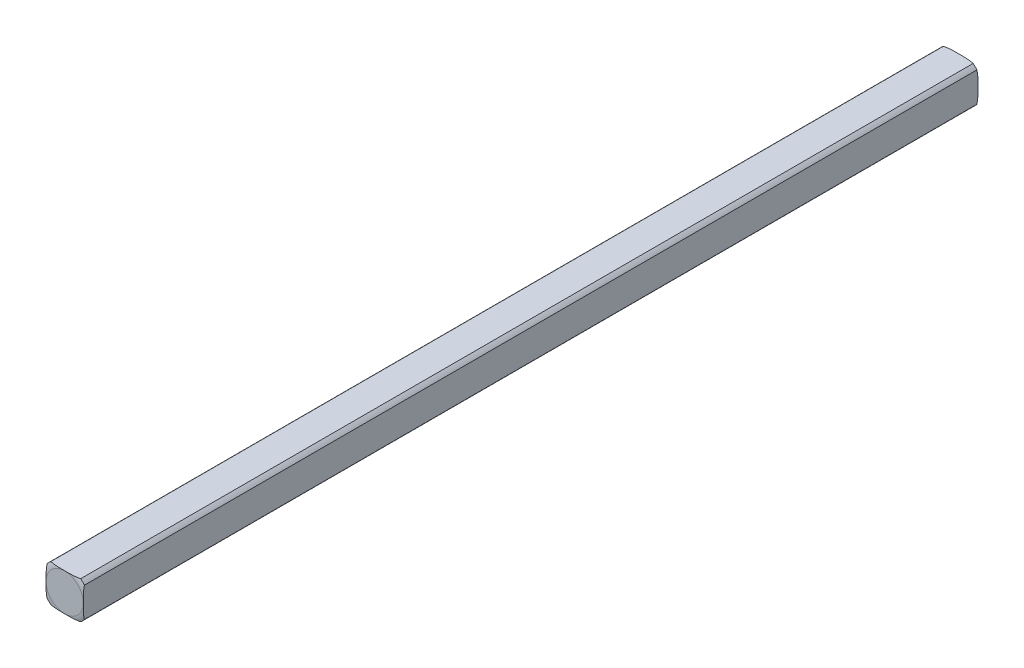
SolidWorks part; units mm, degrees
ref_plane "Front" through (0, 0, 0) normal (0, 0, 1) x (1, 0, 0)
ref_plane "Top" through (0, 0, 0) normal (0, 1, 0) x (1, 0, 0)
ref_plane "Right" through (0, 0, 0) normal (1, 0, 0) x (0, 0, -1)
sketch "Sketch1" plane through (0, 0, 0) normal (0, 0, 1) x (1, 0, 0)
  line L0 (-1.2684, -1.5875) -> (1.2684, -1.5875)
  line L1 (1.5875, -1.2684) -> (1.5875, 1.2684)
  line L2 (1.2684, 1.5875) -> (-1.2684, 1.5875)
  line L3 (-1.5875, 1.2684) -> (-1.5875, -1.2684)
  arc A0 (-1.5875, -1.2684) -> (-1.2684, -1.5875) centre (0, 0) ccw
  arc A1 (1.2684, -1.5875) -> (1.5875, -1.2684) centre (0, 0) ccw
  arc A2 (1.5875, 1.2684) -> (1.2684, 1.5875) centre (0, 0) ccw
  arc A3 (-1.2684, 1.5875) -> (-1.5875, 1.2684) centre (0, 0) ccw
  dimension "D1" = 2.5368
extrude "Boss-Extrude1" add sketch "Sketch1" along normal mid plane 76.2
sketch "Sketch2" plane through (0, 0, 38.1) normal (0, 0, 1) x (1, 0, 0)
  line L4 (-1.2684, -1.5875) -> (1.2684, -1.5875)
  line L5 (1.5875, -1.2684) -> (1.5875, 1.2684)
  line L6 (1.2684, 1.5875) -> (-1.2684, 1.5875)
  line L7 (-1.5875, 1.2684) -> (-1.5875, -1.2684)
  arc A5 (-1.5875, -1.2684) -> (-1.2684, -1.5875) centre (0, 0) ccw
  arc A6 (1.2684, -1.5875) -> (1.5875, -1.2684) centre (0, 0) ccw
  arc A7 (1.5875, 1.2684) -> (1.2684, 1.5875) centre (0, 0) ccw
  arc A8 (-1.2684, 1.5875) -> (-1.5875, 1.2684) centre (0, 0) ccw
  circle A9 centre (0, 0) radius 1.5
  dimension "D2" = 2.5368
sketch "Sketch4" plane through (0, 0, 0) normal (1, 0, 0) x (0, 0, -1)
  line L0 (-37.846, 3.1598) -> (-37.0423, 3.1598)
  line L1 (-38.1, 1.5007) -> (-37.846, 1.5007) construction
  line L2 (-37.846, 1.5007) -> (-37.846, 1.8264) construction
  line L3 (-38.1, 1.5) -> (-38.1, -1.5) construction
  line L4 (-37.0423, 3.1598) -> (-37.594, 2.5922)
  line L5 (-37.846, 3.1598) -> (-39.0752, 3.1598)
  line L6 (-39.0752, 3.1598) -> (-39.0752, 1.5007)
  line L7 (-38.1, 1.5007) -> (-39.0752, 1.5007)
  arc A0 (-38.1, 1.5007) -> (-37.594, 2.5922) centre (-36.7591, 1.5421) cw
  dimension "D1" = 0.254
sweep "Cut-Sweep1" cut profiles "Sketch4" path "Sketch2"
mirror "Mirror1" about plane through (0, 0, 0) normal (0, 0, 1) of "Cut-Sweep1"
